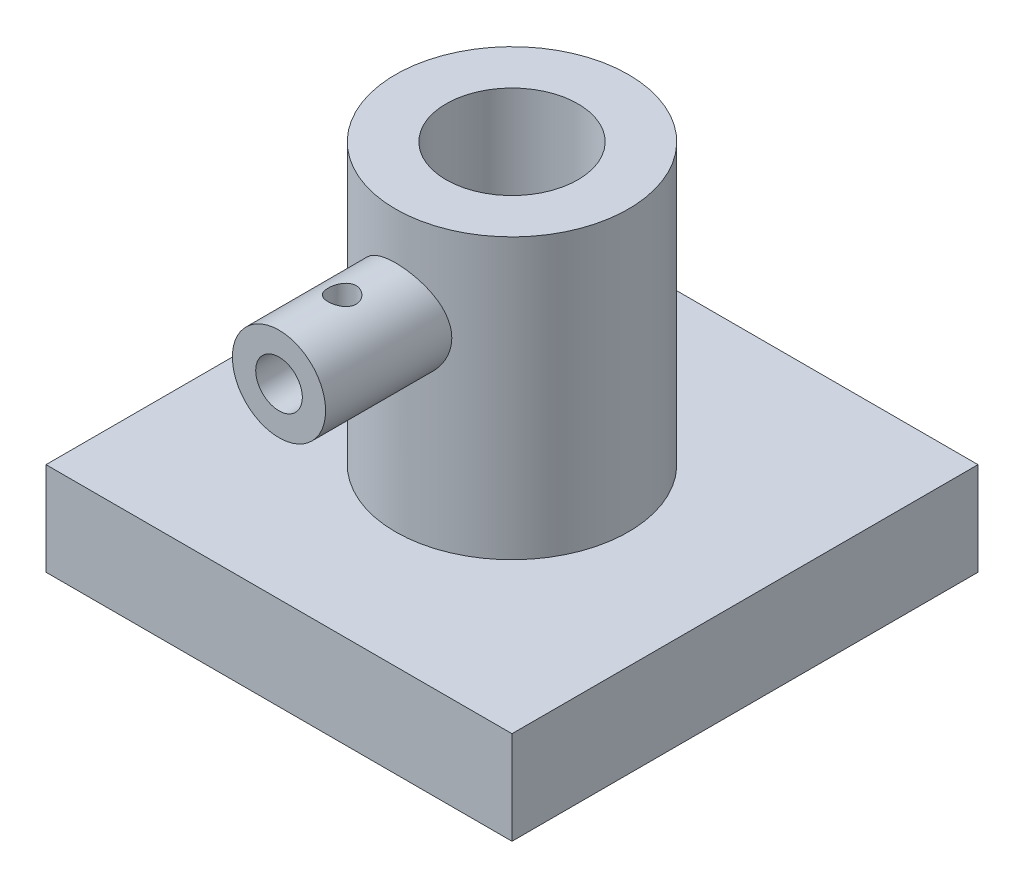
SolidWorks part; units mm, degrees
ref_plane "Front Plane" through (0, 0, 0) normal (0, 0, 1) x (1, 0, 0)
ref_plane "Top Plane" through (0, 0, 0) normal (0, 1, 0) x (1, 0, 0)
ref_plane "Right Plane" through (0, 0, 0) normal (1, 0, 0) x (0, 0, -1)
sketch "Sketch1" plane through (0, 0, 0) normal (0, 1, 0) x (1, 0, 0)
  line L0 (-25, 25) -> (25, -25) construction
  line L1 (-25, 25) -> (25, 25)
  line L2 (-25, 25) -> (-25, -25)
  line L3 (-25, -25) -> (25, -25)
  line L4 (25, 25) -> (25, -25)
  dimension "D1" = 50
  dimension "D2" = 50
extrude "Extrude1" add sketch "Sketch1" against normal blind 10
sketch "Sketch3" plane through (0, 0, 0) normal (0, 1, 0) x (-1, 0, 0)
  circle A0 centre (0, 0) radius 12.5
  dimension "D1" = 25
extrude "Extrude3" add sketch "Sketch3" along normal blind 30
sketch "Sketch4" plane through (0, 0, 0) normal (1, 0, 0) x (0, 0, -1)
  line L0 (0, 20) -> (-25, 20)
  line L2 (-25, 20) -> (-25, 25)
  line L3 (25, 0) -> (-25, 0) construction
  line L4 (-25, 25) -> (0, 25)
  line L5 (0, 25) -> (0, 20)
  dimension "D1" = 20
  dimension "D2" = 25
  dimension "D3" = 5
revolve "Revolve1" add sketch "Sketch4" angle 360 about L0
sketch "Sketch5" plane through (0, 0, 0) normal (1, 0, 0) x (0, 0, -1)
  line L0 (-25, 20) -> (0, 20) construction
  line L1 (-25, 25) -> (-25, 15) construction
  line L2 (-25, 20) -> (-25, 22.5)
  line L3 (-25, 22.5) -> (-8, 22.5)
  line L4 (-8, 22.5) -> (-8, 25)
  line L5 (-8, 25) -> (-5, 25)
  line L6 (-5, 25) -> (-5, 20)
  line L7 (-5, 20) -> (-25, 20)
  dimension "D1" = 2.5
  dimension "D2" = 20
  dimension "D3" = 5
  dimension "D4" = 3
revolve "Cut-Revolve1" cut sketch "Sketch5" angle 360 about L7
sketch "Sketch6" plane through (0, 30, 0) normal (0, 1, 0) x (-1, 0, 0)
  circle A0 centre (0, 0) radius 7.0711
extrude "Cut-Extrude1" cut sketch "Sketch6" against normal through all
sketch "Sketch7" plane through (0, 30, 0) normal (0, 1, 0) x (-1, 0, 0)
  line L0 (-5, 18.2282) -> (5, 18.2282) construction
  line L1 (-5, 25) -> (-5, 11.4564) construction
  line L2 (5, 11.4564) -> (5, 25) construction
  circle A0 centre (0, 18.2282) radius 1.5
  dimension "D1" = 3
extrude "Cut-Extrude2" cut sketch "Sketch7" against normal up to surface (7.5 mm away)
